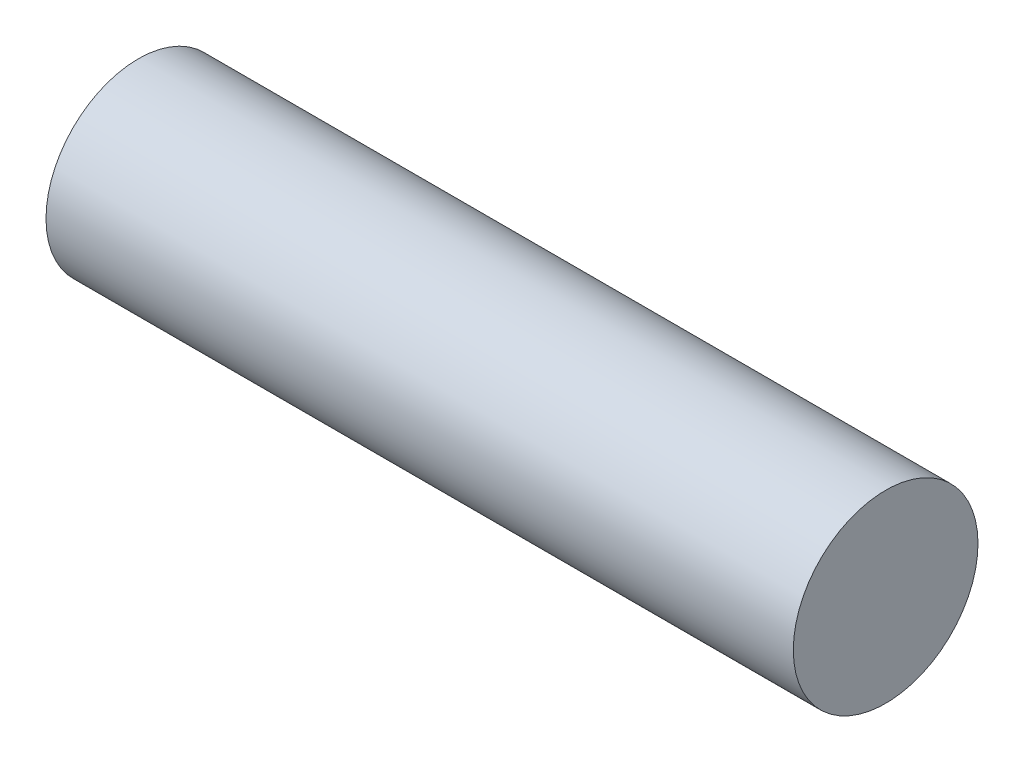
SolidWorks part; units mm, degrees
ref_plane "Vorne" through (0, 0, 0) normal (0, 0, 1) x (1, 0, 0)
ref_plane "Oben" through (0, 0, 0) normal (0, 1, 0) x (1, 0, 0)
ref_plane "Rechts" through (0, 0, 0) normal (1, 0, 0) x (0, 0, -1)
ref_plane "Ebene1" through (0, 0, 8) normal (0, 0, 1) x (1, 0, 0)
sketch "Skizze1" plane through (0, 0, 8) normal (0, 0, 1) x (1, 0, 0)
  line L0 (54.07, 1.25) -> (43.9548, 1.25) construction
  line L1 (0, 0) -> (113.9649, 0) construction
  line L2 (54.07, 0) -> (54.07, 1.25) construction
  line L3 (54.07, 1.25) -> (43.9548, 1.25)
  line L4 (0, 0) -> (113.9649, 0) construction
  line L5 (54.07, 0) -> (54.07, 1.25)
  line L6 (44.305, 0) -> (54.07, 0)
  arc A0 (44.305, 0) -> (43.55, 1.75) centre (41.8993, 0) ccw construction
  arc A1 (44.305, 0) -> (43.9548, 1.25) centre (41.8993, 0) ccw
revolve "Rotation1" add sketch "Skizze1" angle 360 about L4
